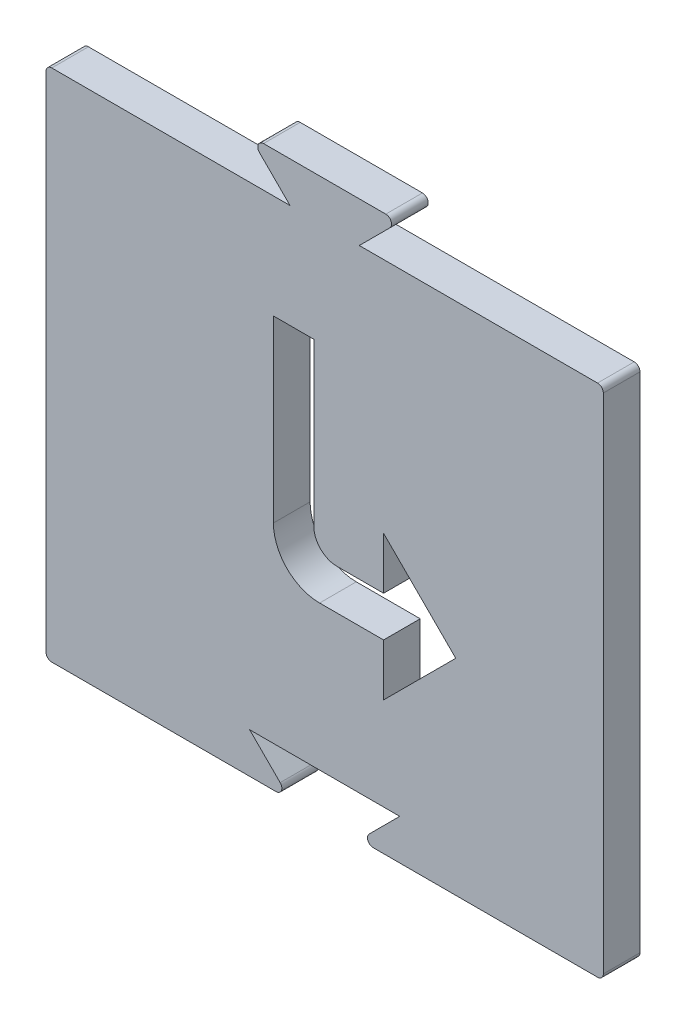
SolidWorks part; units mm, degrees
ref_plane "Front" through (0, 0, 0) normal (0, 0, 1) x (1, 0, 0)
ref_plane "Top" through (0, 0, 0) normal (0, 1, 0) x (1, 0, 0)
ref_plane "Right" through (0, 0, 0) normal (1, 0, 0) x (0, 0, -1)
sketch "Sketch1" plane through (0, 0, 0) normal (0, 0, 1) x (1, 0, 0)
  line L0 (0, 0) -> (0, 35.56) construction
  line L1 (48.26, 35.56) -> (48.26, 0)
  line L2 (48.26, 0) -> (0, 0) construction
  line L3 (0, 35.56) -> (48.26, 35.56) construction
  line L4 (0, 17.78) -> (48.26, 17.78) construction
  line L5 (24.13, 35.56) -> (24.13, 0) construction
  line L6 (0, 35.56) -> (0, 44.56)
  line L7 (0, 44.56) -> (21.13, 44.56)
  line L8 (21.13, 44.56) -> (17.63, 48.06)
  line L9 (17.63, 48.06) -> (30.63, 48.06)
  line L10 (30.63, 48.06) -> (27.13, 44.56)
  line L11 (0, 0) -> (21.13, 0)
  line L12 (21.13, 0) -> (17.63, 3.5)
  line L13 (17.63, 3.5) -> (30.63, 3.5)
  line L14 (30.63, 3.5) -> (27.13, 0)
  line L15 (27.13, 0) -> (48.26, 0)
  line L16 (0, 35.56) -> (0, 0)
  line L28 (27.13, 44.56) -> (48.26, 44.56)
  line L29 (48.26, 44.56) -> (48.26, 35.56)
  point P0 (24.13, 48.06)
  point P18 (24.13, 3.5)
  dimension "D2" = 35.56
  dimension "D3" = 48.26
  dimension "D4" = 9
  dimension "D5" = 3
  dimension "D6" = 3
  dimension "D7" = 3.5
  dimension "D8" = 45
  dimension "D15" = 3.5
  dimension "D17" = 45
extrude "Boss-Extrude1" add sketch "Sketch1" along normal blind 3.175
sketch "Sketch4" plane through (0, 0, 3.175) normal (0, 0, 1) x (1, 0, 0)
  line L0 (23.1926, 35.56) -> (23.1926, 19.53)
  line L1 (23.1926, 19.53) -> (29.2315, 19.53)
  line L2 (29.2315, 19.53) -> (29.2315, 24.03)
  line L3 (29.2315, 24.03) -> (35.4815, 17.78)
  line L4 (35.4815, 17.78) -> (29.2315, 11.53)
  line L5 (29.2315, 11.53) -> (29.2315, 16.03)
  line L6 (29.2315, 16.03) -> (19.6926, 16.03)
  line L7 (19.6926, 16.03) -> (19.6926, 35.56)
  line L8 (19.6926, 35.56) -> (23.1926, 35.56)
  line L9 (29.2315, 19.53) -> (29.2315, 16.03) construction
  line L11 (27.13, 0) -> (48.26, 0) construction
  line L15 (35.4815, 17.78) -> (19.6926, 17.78) construction
  dimension "D1" = 3.5
  dimension "D2" = 4.5
  dimension "D3" = 17.78
  dimension "D5" = 19.53
extrude "Cut-Extrude2" cut sketch "Sketch4" against normal through all
fillet "Fillet1" radius 2 1 edges at (23.1926, 19.53, 1.5875)
fillet "Fillet2" radius 4 1 edges at (19.6926, 16.03, 1.5875)
fillet "Fillet3" radius 0.5 8 edges at (27.13, 0, 1.5875) (21.13, 0, 1.5875) (48.26, 44.56, 1.5875) (30.63, 48.06, 1.5875) (17.63, 48.06, 1.5875) (0, 44.56, 1.5875) (48.26, 0, 1.5875) (0, 0, 1.5875)
